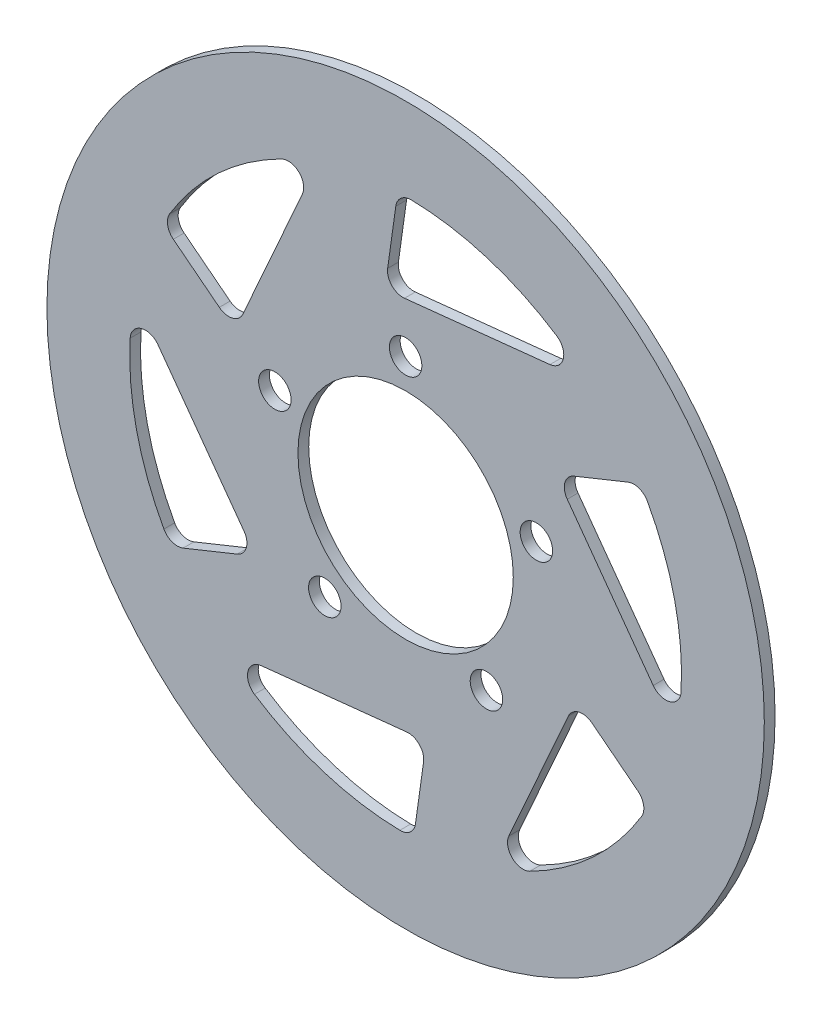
SolidWorks part; units mm, degrees
ref_plane "Front Plane" through (0, 0, 0) normal (0, 0, 1) x (1, 0, 0)
ref_plane "Top Plane" through (0, 0, 0) normal (0, 1, 0) x (1, 0, 0)
ref_plane "Right Plane" through (0, 0, 0) normal (1, 0, 0) x (0, 0, -1)
sketch "Sketch1" plane through (0, 0, 0) normal (0, 0, 1) x (1, 0, 0)
  line L0 (-3.175, 28.3981) -> (-1.2237, 42.2823)
  line L1 (28.032, 31.678) -> (-3.175, 28.3981)
  line L2 (0, 0) -> (0, 84.8514) construction
  circle A0 centre (0, 0) radius 55
  circle A1 centre (0, 21.082) radius 2.4892
  arc A2 (-1.2237, 42.2823) -> (28.032, 31.678) centre (0, 0) cw
  circle A3 centre (0, 0) radius 16.51
  dimension "D1" = 110
  dimension "D3" = 4.9784
  dimension "D4" = 12.7
  dimension "D9" = 33.02
  dimension "D2" = 21.082
  dimension "D5" = 28.575
  dimension "D6" = 3.175
  dimension "D7" = 8
  dimension "D8" = 76
sketch "Sketch2" plane through (0, 0, 0) normal (0, 0, 1) x (1, 0, 0)
  circle A0 centre (0, 0) radius 55 construction
  circle A1 centre (0, 0) radius 55
  circle A2 centre (0, 0) radius 16.51 construction
  circle A3 centre (0, 0) radius 16.51
extrude "Boss-Extrude1" add sketch "Sketch2" along normal blind 1.651
sketch "Sketch3" plane through (0, 0, 0) normal (0, 0, 1) x (1, 0, 0)
  circle A0 centre (0, 21.082) radius 2.4892 construction
  circle A1 centre (0, 21.082) radius 2.4892
extrude "Cut-Extrude2" cut sketch "Sketch3" along normal through all
pattern_circular "CirPattern1" count 5 over 360 about axis through (0, 0, 0) along (0, 0, 1) of "Cut-Extrude2"
sketch "Sketch4" plane through (0, 0, 0) normal (0, 0, 1) x (1, 0, 0)
  line L0 (-3.175, 28.3981) -> (-1.2237, 42.2823) construction
  line L1 (28.032, 31.678) -> (-3.175, 28.3981) construction
  line L2 (-2.7542, 31.3921) -> (-1.5082, 40.2579)
  line L3 (22.1326, 31.058) -> (-0.1681, 28.7141)
  arc A0 (28.032, 31.678) -> (-1.2237, 42.2823) centre (0, 0) ccw construction
  arc A1 (23.1802, 35.3832) -> (0.8802, 42.2908) centre (0, 0) ccw
  arc A2 (23.1802, 35.3832) -> (22.1326, 31.058) centre (21.8857, 33.4073) cw
  arc A3 (-1.5082, 40.2579) -> (0.8802, 42.2908) centre (0.831, 39.9292) cw
  arc A4 (-2.7542, 31.3921) -> (-0.1681, 28.7141) centre (-0.415, 31.0634) ccw
  dimension "D1" = 2.3622
extrude "Cut-Extrude3" cut sketch "Sketch4" along normal through all
pattern_circular "CirPattern2" count 6 over 360 about axis through (0, 0, 0) along (0, 0, 1) of "Cut-Extrude3"
